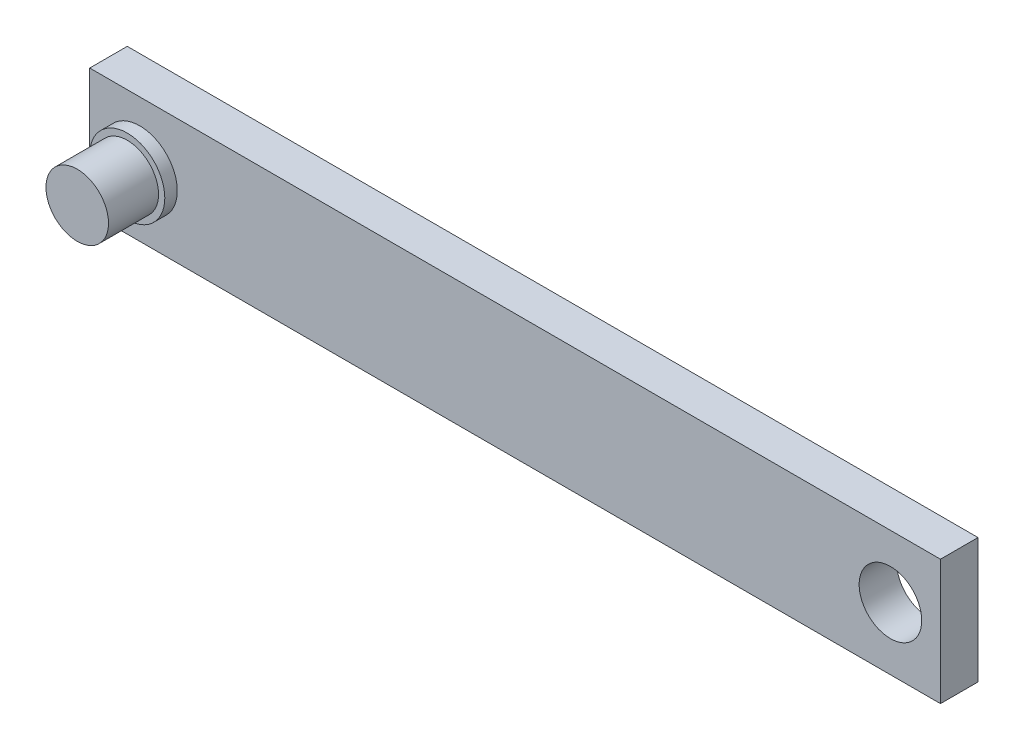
SolidWorks part; units mm, degrees
ref_plane "正面" through (0, 0, 0) normal (0, 0, 1) x (1, 0, 0)
ref_plane "平面" through (0, 0, 0) normal (0, 1, 0) x (1, 0, 0)
ref_plane "右側面" through (0, 0, 0) normal (1, 0, 0) x (0, 0, -1)
sketch "ｽｹｯﾁ1" plane through (0, 0, 0) normal (0, 0, 1) x (1, 0, 0)
  line L1 (0, 0) -> (680, 0)
  line L2 (0, 0) -> (0, 100)
  line L3 (0, 100) -> (680, 100)
  line L4 (680, 0) -> (680, 100)
  dimension "D1" = 680
  dimension "D2" = 100
extrude "押し出し1" add sketch "ｽｹｯﾁ1" along normal blind 30
sketch "ｽｹｯﾁ2" plane through (0, 0, 30) normal (0, 0, 1) x (1, 0, 0)
  line L0 (0, 0) -> (680, 0) construction
  line L3 (0, 100) -> (0, 0) construction
  circle A0 centre (40, 50) radius 30
  dimension "D1" = 60
  dimension "D2" = 50
  dimension "D3" = 40
extrude "押し出し2" add sketch "ｽｹｯﾁ2" along normal blind 10
sketch "ｽｹｯﾁ3" plane through (0, 0, 40) normal (0, 0, 1) x (1, 0, 0)
  circle A0 centre (40, 50) radius 25
  dimension "D1" = 50
extrude "押し出し3" add sketch "ｽｹｯﾁ3" along normal blind 40
sketch "ｽｹｯﾁ4" plane through (0, 0, 30) normal (0, 0, 1) x (1, 0, 0)
  line L0 (680, 0) -> (680, 100) construction
  line L3 (0, 0) -> (680, 0) construction
  circle A0 centre (640, 50) radius 25
  dimension "D1" = 50
  dimension "D2" = 40
  dimension "D3" = 50
extrude "押し出し4" cut sketch "ｽｹｯﾁ4" against normal through all
